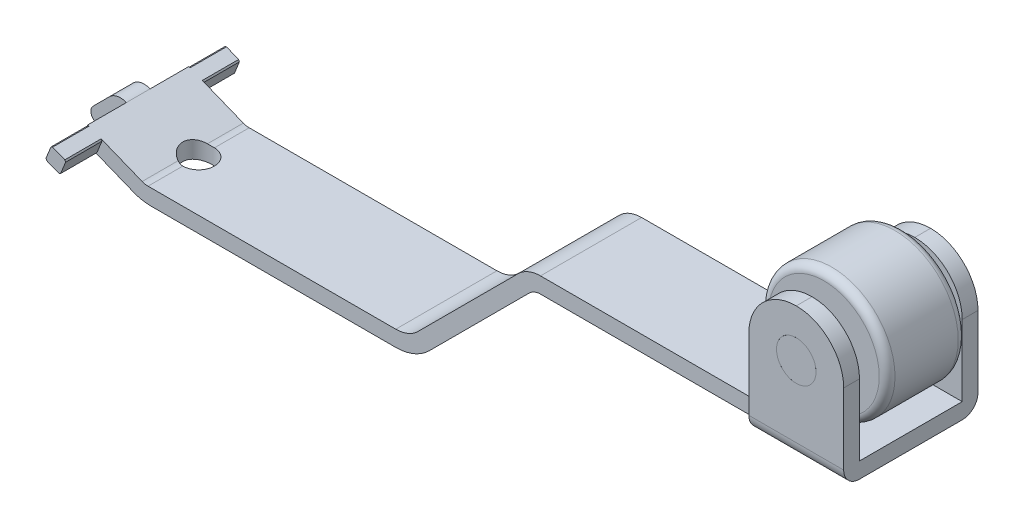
SolidWorks part; units mm, degrees
ref_plane "Plan de face" through (0, 0, 0) normal (0, 0, 1) x (1, 0, 0)
ref_plane "Plan de dessus" through (0, 0, 0) normal (0, 1, 0) x (1, 0, 0)
ref_plane "Plan de droite" through (0, 0, 0) normal (1, 0, 0) x (0, 0, -1)
sketch "Esquisse1" plane through (0, 0, 0) normal (0, 0, 1) x (1, 0, 0)
  line L0 (0, 0) -> (3.2496, -1.3) construction
  line L1 (3.2496, -1.3) -> (20.2496, -1.3) construction
  line L2 (3.3459, -0.8) -> (20.0425, -0.8) construction
  line L3 (-0.1857, -0.4642) -> (3.1533, -1.8)
  line L4 (3.1533, -1.8) -> (19.2141, -1.8)
  line L5 (20.2496, -1.3) -> (27.7496, 6.2) construction
  line L6 (0.1857, 0.4642) -> (3.3459, -0.8)
  line L7 (3.3459, -0.8) -> (19.2141, -0.8)
  line L8 (21.3354, -0.9213) -> (27.6638, 5.4071)
  line L9 (20.6283, -0.2142) -> (26.9567, 6.1142)
  line L10 (-0.1857, -0.4642) -> (3.1533, -1.8) construction
  line L11 (0.1857, 0.4642) -> (-0.2785, 0.6499)
  line L12 (-0.2785, 0.6499) -> (-0.6499, -0.2785)
  line L13 (-0.6499, -0.2785) -> (-0.1857, -0.4642)
  line L14 (0.5, 0.3385) -> (0.5, -0.7385) construction
  line L15 (20.0425, -0.8) -> (36.7254, 15.8829) construction
  line L16 (20.4567, -1.8) -> (37.4325, 15.1758) construction
  line L17 (20.2496, -1.3) -> (37.0789, 15.5293) construction
  line L18 (28.3709, 5.7) -> (48.6062, 5.7)
  line L19 (20.6032, -1.6536) -> (28.1032, 5.8464) construction
  line L20 (3.1533, -1.8) -> (20.4567, -1.8) construction
  line L21 (19.8961, -0.9464) -> (27.3961, 6.5536) construction
  line L22 (27.7496, 6.2) -> (48.6062, 6.2) construction
  line L23 (28.3709, 6.7) -> (48.6062, 6.7)
  line L24 (27.7496, 6.7) -> (48.6062, 6.7) construction
  line L25 (27.7496, 5.7) -> (48.6062, 5.7) construction
  line L26 (48.6062, 6.7) -> (48.6062, 5.7)
  arc A0 (0.1857, 0.4642) -> (-0.1857, -0.4642) centre (0, 0) ccw construction
  circle A1 centre (0, 0) radius 0.65 construction
  arc A2 (19.2141, -0.8) -> (20.6283, -0.2142) centre (19.2141, 1.2) ccw
  arc A3 (19.2141, -1.8) -> (21.3354, -0.9213) centre (19.2141, 1.2) ccw
  arc A4 (28.3709, 6.7) -> (26.9567, 6.1142) centre (28.3709, 4.7) ccw
  arc A5 (27.6638, 5.4071) -> (28.3709, 5.7) centre (28.3709, 4.7) cw
  dimension "D4" = 0.5
  dimension "D7" = 1.3
  dimension "D11" = 2
  dimension "D12" = 3
  dimension "D15" = 2
  dimension "D16" = 1
  dimension "D1" = 3.5
  dimension "D2" = 17
  dimension "D3" = 135
  dimension "D9" = 1.8
  dimension "D10" = 7.5
  dimension "D17" = 49
  dimension "D5" = 0.5
  dimension "D6" = 0.5
  dimension "D8" = 0.5
  dimension "D13" = 0.5
  dimension "D14" = 0.5
extrude "Boss.-Extru.1" add sketch "Esquisse1" along normal mid plane 6.4
sketch "Esquisse2" plane through (0, 0, 0) normal (0, 0, 1) x (1, 0, 0)
  line L0 (-0.2785, 0.6499) -> (-0.6499, -0.2785) construction
  line L2 (-0.2785, 0.6499) -> (-0.6499, -0.2785)
  line L3 (0.6499, 0.2785) -> (0.2785, -0.6499)
  line L4 (-0.2785, 0.6499) -> (0.6499, 0.2785)
  line L5 (-0.6499, -0.2785) -> (0.2785, -0.6499)
  line L7 (-0.6499, -0.2785) -> (3.1533, -1.8) construction
extrude "Boss.-Extru.2" add sketch "Esquisse2" along normal mid plane 11
sketch "Esquisse3" plane through (0, 0, 5.5) normal (0, 0, 1) x (1, 0, 0)
  circle A0 centre (0, 0) radius 0.65
  dimension "D1" = 1.3
extrude "Enlèv. mat.-Extru.1" cut sketch "Esquisse3" against normal up to surface (2.3 mm away) flip side to cut
sketch "Esquisse4" plane through (0, 0, -5.5) normal (0, 0, -1) x (-1, 0, 0)
  circle A0 centre (0, 0) radius 0.65 construction
  circle A1 centre (0, 0) radius 0.65
extrude "Enlèv. mat.-Extru.2" cut sketch "Esquisse4" against normal up to surface (2.3 mm away) flip side to cut
sketch "Esquisse5" plane through (0, 0, 0) normal (0, 0, 1) x (1, 0, 0)
  line L0 (-0.2785, 0.6499) -> (-0.1999, 0.6185) construction
  line L1 (-0.31, 0.5713) -> (-0.2785, 0.6499) construction
  line L2 (-0.6499, -0.2785) -> (-0.6185, -0.1999) construction
  line L3 (-0.5713, -0.31) -> (-0.6499, -0.2785) construction
  line L4 (-0.2785, 0.6499) -> (-0.1999, 0.6185)
  line L5 (-0.31, 0.5713) -> (-0.2785, 0.6499)
  line L6 (-0.6499, -0.2785) -> (-0.6185, -0.1999)
  line L7 (-0.5713, -0.31) -> (-0.6499, -0.2785)
  arc A0 (-0.1999, 0.6185) -> (-0.31, 0.5713) centre (0, 0) ccw construction
  arc A1 (-0.6185, -0.1999) -> (-0.5713, -0.31) centre (0, 0) ccw construction
  arc A2 (-0.1999, 0.6185) -> (-0.31, 0.5713) centre (0, 0) ccw
  arc A3 (-0.6185, -0.1999) -> (-0.5713, -0.31) centre (0, 0) ccw
sketch "Esquisse6" plane through (0, 0, 0) normal (0, 0, 1) x (1, 0, 0)
  line L0 (-0.6499, -0.2785) -> (-1.675, -1.3036)
  line L2 (-2.3821, -0.5964) -> (-1.3571, 0.4286)
  line L3 (-0.4642, 0.1857) -> (1.5431, 0.1857) construction
  line L7 (-0.2785, 0.6499) -> (-0.6499, -0.2785) construction
  line L8 (-0.2785, 0.6499) -> (-0.6499, -0.2785)
  line L9 (-2.0285, -0.95) -> (-2.0878, -2.0756) construction
  arc A0 (-0.2785, 0.6499) -> (-1.3571, 0.4286) centre (-0.6499, -0.2785) ccw
  arc A1 (-2.3821, -0.5964) -> (-1.675, -1.3036) centre (-2.0285, -0.95) ccw
  point P1 (-1.9768, -1.9768)
  point P4 (-2.6839, -1.2697)
  dimension "D1" = 135
  dimension "D2" = 0.95
extrude "Boss.-Extru.3" add sketch "Esquisse6" along normal mid plane 1.5
fillet "Congé1" radius 3 1 edges at (3.1533, -1.8, 0)
fillet "Congé2" radius 1 1 edges at (3.3459, -0.8, 0)
sketch "Esquisse7" plane through (0, -0.8, 0) normal (0, 1, 0) x (1, 0, 0)
  line L0 (3.5385, 3.2) -> (3.5385, -3.2) construction
  circle A0 centre (3.5385, 0) radius 1
  dimension "D1" = 2
extrude "Enlèv. mat.-Extru.3" cut sketch "Esquisse7" against normal through all and the other way through all
sketch "Esquisse8" plane through (48.6062, 0, 0) normal (1, 0, 0) x (0, 0, -1)
  line L0 (3.2, 6.7) -> (3.25, 6.7)
  line L1 (3.25, 6.7) -> (3.25, 14.2)
  line L2 (3.25, 14.2) -> (4.25, 14.2)
  line L3 (4.25, 14.2) -> (4.25, 6.7)
  line L4 (3.25, 5.7) -> (3.2, 5.7)
  line L5 (-3.2, 5.7) -> (3.2, 5.7) construction
  line L6 (3.2, 5.7) -> (3.2, 6.7) construction
  line L7 (0, 5.7) -> (0, 8.7191) construction
  line L8 (-3.25, 5.7) -> (-3.2, 5.7)
  line L9 (-4.25, 14.2) -> (-4.25, 6.7)
  line L10 (-3.25, 14.2) -> (-4.25, 14.2)
  line L11 (-3.25, 6.7) -> (-3.25, 14.2)
  line L12 (-3.2, 6.7) -> (-3.25, 6.7)
  line L13 (3.2, 6.7) -> (3.2, 5.7)
  line L14 (-3.2, 6.7) -> (-3.2, 5.7)
  arc A0 (4.25, 6.7) -> (3.25, 5.7) centre (3.25, 6.7) cw
  arc A1 (-4.25, 6.7) -> (-3.25, 5.7) centre (-3.25, 6.7) ccw
  dimension "D2" = 7.5
  dimension "D3" = 6.5
extrude "Boss.-Extru.4" add sketch "Esquisse8" against normal blind 6
fillet "Congé3" radius 3 4 edges at (42.6062, 14.2, 3.75) (48.6062, 14.2, 3.75) (42.6062, 14.2, -3.75) (48.6062, 14.2, -3.75)
sketch "Esquisse9" plane through (0, 0, 0) normal (0, 0, 1) x (1, 0, 0)
  circle A0 centre (45.6062, 11.2) radius 1.25
  arc A1 (48.6062, 11.2) -> (45.6062, 14.2) centre (45.6062, 11.2) ccw construction
  dimension "D1" = 2.5
extrude "Enlèv. mat.-Extru.4" cut sketch "Esquisse9" against normal mid plane 10
sketch "Esquisse10" plane through (0, 0, 0) normal (0, 0, 1) x (1, 0, 0)
  circle A0 centre (45.6062, 11.2) radius 1.25 construction
  circle A1 centre (45.6062, 11.2) radius 1.25
extrude "Boss.-Extru.5" add sketch "Esquisse10" against normal up to surface and the other way up to surface separate body
sketch "Esquisse11" plane through (0, 0, 0) normal (0, 0, 1) x (1, 0, 0)
  circle A0 centre (45.6062, 11.2) radius 4
  circle A1 centre (45.6062, 11.2) radius 1.25 construction
  circle A2 centre (45.6062, 11.2) radius 1.25
  dimension "D1" = 8
extrude "Boss.-Extru.6" add sketch "Esquisse11" along normal mid plane 5 separate body
fillet "Congé4" radius 0.5 2 edges at (49.6062, 11.2, -2.5) (49.6062, 11.2, 2.5)
